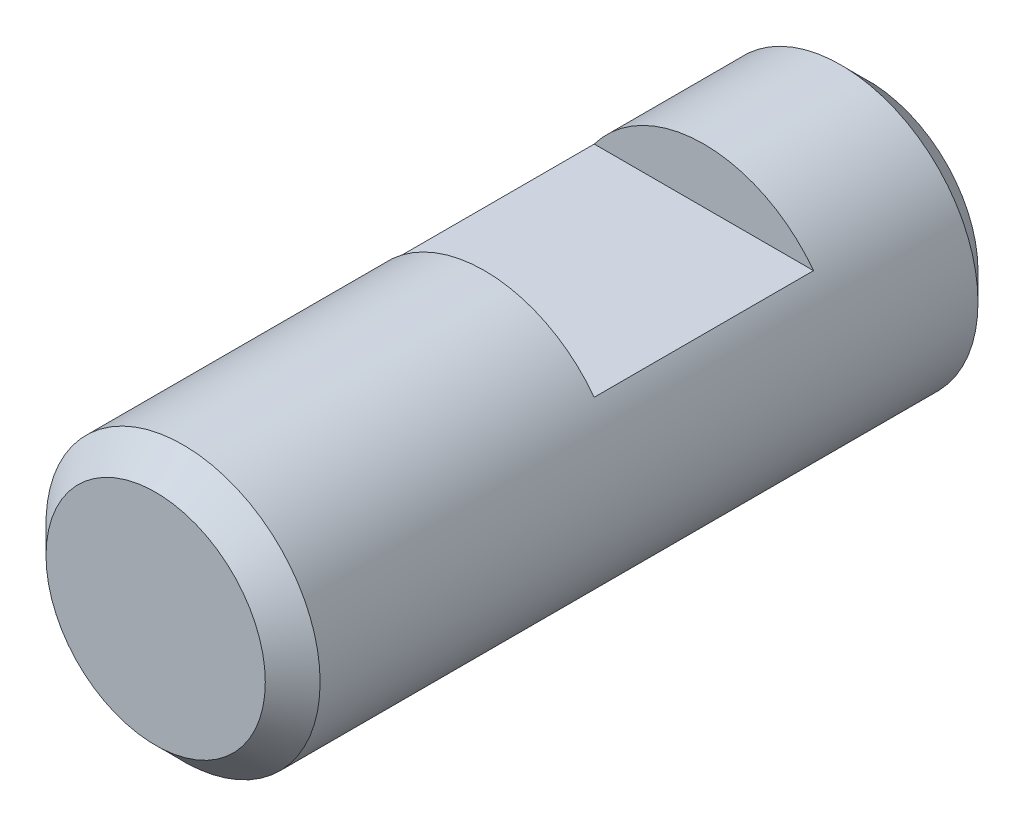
SolidWorks part; units mm, degrees
ref_plane "Plane1" through (0, 0, 0) normal (0, 0, 1) x (1, 0, 0)
ref_plane "Plane2" through (0, 0, 0) normal (0, 1, 0) x (1, 0, 0)
ref_plane "Plane3" through (0, 0, 0) normal (1, 0, 0) x (0, 0, -1)
sketch "Esquisse1" plane through (0, 0, 0) normal (0, 0, 1) x (1, 0, 0)
  circle A0 centre (0, 0) radius 5
  dimension "D1" = 10
extrude "Base-Extrusion" add sketch "Esquisse1" along normal blind 26
ref_plane "Plan4" through (0, 3, 0) normal (0, 1, 0) x (-1, 0, 0)
sketch "Esquisse2" plane through (0, 3, 0) normal (0, 1, 0) x (-1, 0, 0)
  line L0 (-8, 14) -> (8, 14)
  line L1 (-8, 14) -> (-8, 6)
  line L2 (8, 6) -> (-8, 6)
  line L3 (8, 6) -> (8, 14)
  line L4 (-5, 0) -> (5, 0) construction
  dimension "D1" = 6
  dimension "D2" = 8
extrude "Enlèv. mat.-Extru.1" cut sketch "Esquisse2" along normal blind 6
chamfer "Chanfrein1" distance 1 angle 45
chamfer "Chanfrein2" distance 1 angle 45
